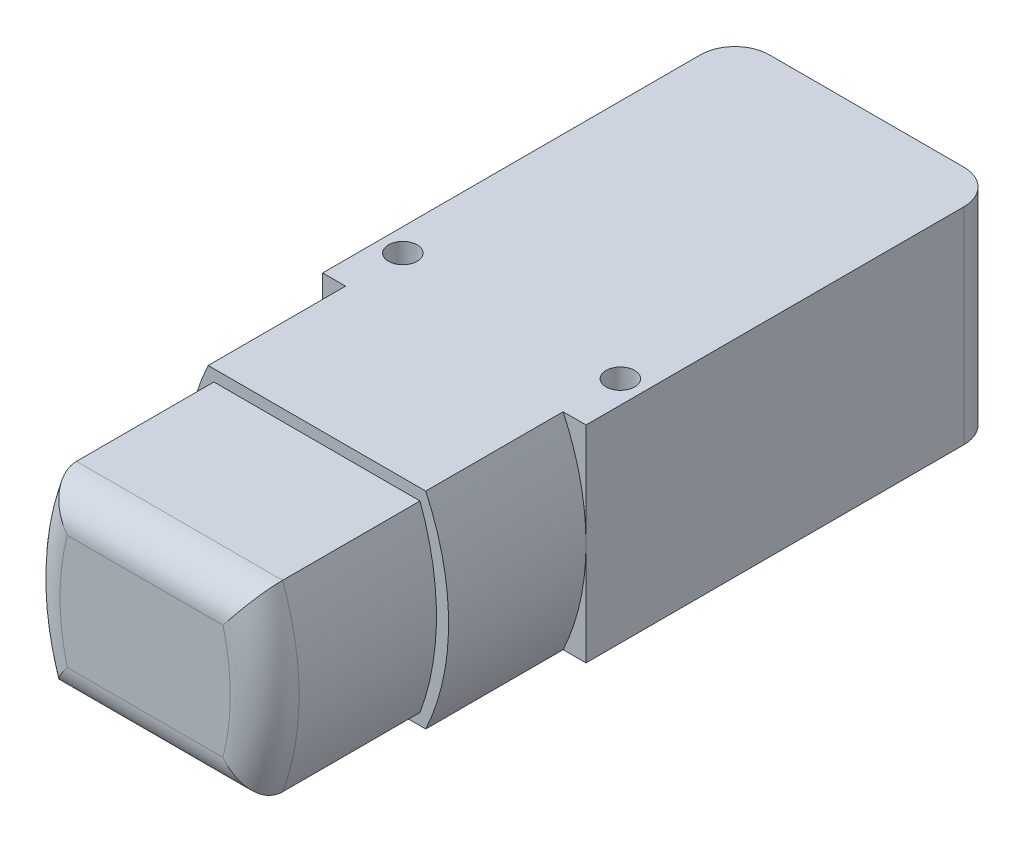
SolidWorks part; units mm, degrees
ref_plane "Alzado" through (0, 0, 0) normal (0, 0, 1) x (1, 0, 0)
ref_plane "Planta" through (0, 0, 0) normal (0, 1, 0) x (1, 0, 0)
ref_plane "Vista lateral" through (0, 0, 0) normal (1, 0, 0) x (0, 0, -1)
sketch "Croquis1" plane through (0, 0, 0) normal (0, 0, 1) x (1, 0, 0)
  line L1 (-11.5, 9) -> (11.5, 9)
  line L2 (-11.5, 9) -> (-11.5, -9)
  line L3 (-11.5, -9) -> (11.5, -9)
  line L4 (11.5, 9) -> (11.5, -9)
  line L5 (-11.5, 9) -> (11.5, -9) construction
  line L6 (-11.5, -9) -> (11.5, 9) construction
  point P0 (0, 0)
  dimension "D1" = 23
  dimension "D2" = 18
extrude "Saliente-Extruir1" add sketch "Croquis1" along normal blind 36
fillet "Redondeo1" radius 3 2 edges at (11.5, 0, 0) (-11.5, 0, 0)
sketch "Croquis2" plane through (0, 0, 36) normal (0, 0, 1) x (1, 0, 0)
  line L0 (-9.5, 9) -> (9.5, 9)
  line L1 (11.5, 9) -> (-11.5, 9) construction
  line L2 (-9.5, -9) -> (9.5, -9)
  line L3 (-11.5, -9) -> (11.5, -9) construction
  arc A0 (-9.5, 9) -> (-9.5, -9) centre (9.75, 0) ccw
  arc A1 (9.5, 9) -> (9.5, -9) centre (-9.75, 0) cw
  dimension "D3" = 21.25
  dimension "D4" = 21.25
  dimension "D1" = 19
  dimension "D2" = 9.5
  dimension "D5" = 18
  dimension "D6" = 18
extrude "Saliente-Extruir2" add sketch "Croquis2" along normal blind 12
sketch "Croquis3" plane through (0, 0, 48) normal (0, 0, 1) x (1, 0, 0)
  line L0 (-9, 8) -> (9, 8)
  line L1 (-9, -8) -> (9, -8)
  arc A0 (9, 8) -> (9, -8) centre (-12.5639, 0) cw
  arc A2 (-9, 8) -> (-9, -8) centre (12.5639, 0) ccw
  dimension "D5" = 23
  dimension "D6" = 23
  dimension "D1" = 18
  dimension "D2" = 9
  dimension "D3" = 1
  dimension "D4" = 1
  dimension "D7" = 18
  dimension "D8" = 9
extrude "Saliente-Extruir3" add sketch "Croquis3" along normal blind 15
fillet "Redondeo2" radius 3 4 edges at (10.4361, 0, 63) (0, 8, 63) (-10.4361, 0, 63) (0, -8, 63)
sketch "Croquis4" plane through (0, -9, 0) normal (0, -1, 0) x (1, 0, 0)
  line L0 (-8.5, 0) -> (8.5, 0) construction
  circle A0 centre (0, 10) radius 2.5
  dimension "D1" = 5
  dimension "D2" = 10
sketch "Croquis8" plane through (0, -9, 0) normal (0, -1, 0) x (1, 0, 0)
  circle A0 centre (-9.5, 31) radius 1.25
  circle A1 centre (9.5, 31) radius 1.25
  dimension "D1" = 2.5
  dimension "D4" = 2.5
  dimension "D2" = 5
  dimension "D3" = 2
  dimension "D5" = 5
  dimension "D6" = 2
extrude "Cortar-Extruir3" cut sketch "Croquis8" against normal through all
